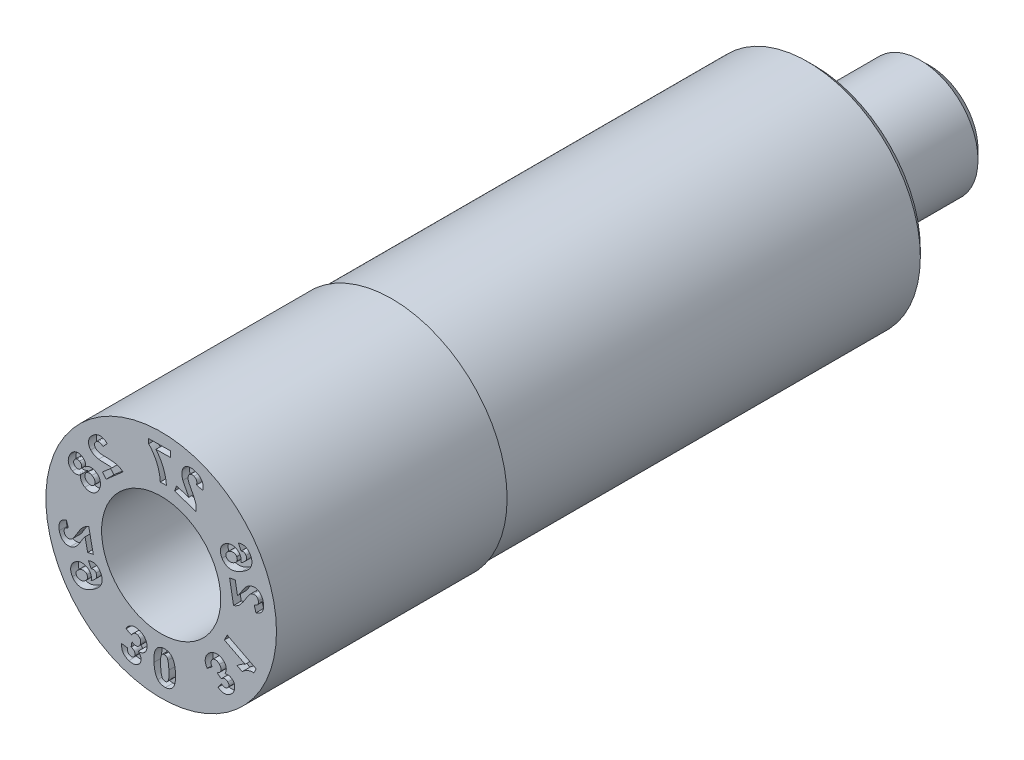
SolidWorks part; units mm, degrees
other "<M3 X .5 SHSS>-<Revolve1>"
ref_plane "Front Plane" through (0, 0, 0) normal (0, 0, 1) x (1, 0, 0)
ref_plane "Top Plane" through (0, 0, 0) normal (0, 1, 0) x (1, 0, 0)
ref_plane "Right Plane" through (0, 0, 0) normal (1, 0, 0) x (0, 0, -1)
sketch "Sketch1" plane through (0, 0, 0) normal (1, 0, 0) x (0, 0, -1)
  line L2 (0, 3) -> (0, 1.55)
  line L3 (16.75, 3) -> (0, 3)
  line L4 (-3.7979, 0) -> (49996.2021, 0) construction
  line L8 (14, 0.8) -> (2.8, 0.8)
  line L9 (2.8, 1.55) -> (2.8, 0.8)
  line L10 (2.8, 1.55) -> (0, 1.55)
  line L12 (17, 1.5) -> (17, 2.75)
  line L16 (17, 2.75) -> (16.75, 3)
  line L17 (17, 1.5) -> (14, 1.5)
  line L18 (14, 0.8) -> (14, 1.5)
  dimension "D1" = 17
  dimension "D2" = 45
  dimension "D3" = 0.25
  dimension "D4" = 6
  dimension "D5" = 3.1
  dimension "D6" = 2.8
  dimension "D7" = 1.6
  dimension "D8" = 3
  dimension "D9" = 3
revolve "Revolve1" add sketch "Sketch1" angle 360 about L4
sketch "Sketch4" plane through (0, 0, 0) normal (1, 0, 0) x (0, 0, -1)
  line L0 (0, 0) -> (50000, 0) construction
  line L1 (17, -2.75) -> (17, 2.75) construction
  line L2 (6, 3.935) -> (17, 3.935)
  line L3 (6, 3.935) -> (6, 2.935)
  line L4 (6, 2.935) -> (17, 2.935)
  line L5 (17, 3.935) -> (17, 2.935)
  line L6 (16.75, 3) -> (0, 3) construction
  line L9 (0, 3.3) -> (0, -3.3) construction
  dimension "D1" = 1
  dimension "D2" = 0.065
  dimension "D3" = 6
revolve "Cut-Revolve1" cut sketch "Sketch4" angle 360 about L0
sketch "Sketch2" plane through (0, 0, 0) normal (0, 0, 1) x (1, 0, 0)
  line L0 (0, 0) -> (0, 3.6959) construction
  line L1 (0, 0) -> (3.2008, 1.848) construction
  line L2 (0, 0) -> (3.2008, -1.848) construction
  line L3 (0, 0) -> (0, -3.6959) construction
  line L4 (0, 0) -> (-3.2008, -1.848) construction
  line L5 (0, 0) -> (-3.2008, 1.848) construction
  circle A0 centre (0, 0) radius 1.8893 construction
  text T0 "26  27  28  29  30  31" font "Arial" height 0.85
  point P10 (0, 0)
  point P849 (0, 0.0048)
  point P850 (0.0048, 0.0048)
  point P851 (0.0048, 0)
  dimension "D1" = 6
extrude "Cut-Extrude1" cut sketch "Sketch2" against normal blind 0.2
sketch "Sketch3" plane through (0, 0, -2.8) normal (0, 0, 1) x (1, 0, 0)
  line L0 (0, 0) -> (0, 50000) construction
  line L1 (0.4619, 0.8) -> (-0.4619, 0.8)
  line L2 (-0.4619, 0.8) -> (-0.9238, 0)
  line L3 (-0.9238, 0) -> (-0.4619, -0.8)
  line L4 (-0.4619, -0.8) -> (0.4619, -0.8)
  line L5 (0.4619, -0.8) -> (0.9238, 0)
  line L6 (0.9238, 0) -> (0.4619, 0.8)
  line L7 (0, 0) -> (50000, 0) construction
  circle A0 centre (0, 0) radius 0.8 construction
  circle A1 centre (0, 0) radius 0.8 construction
extrude "Cut-Extrude2" cut sketch "Sketch3" against normal blind 1.4
inserted part "M3 X .5 SHSS"
move or copy body "Body-Move/Copy2" placed by mates yes
